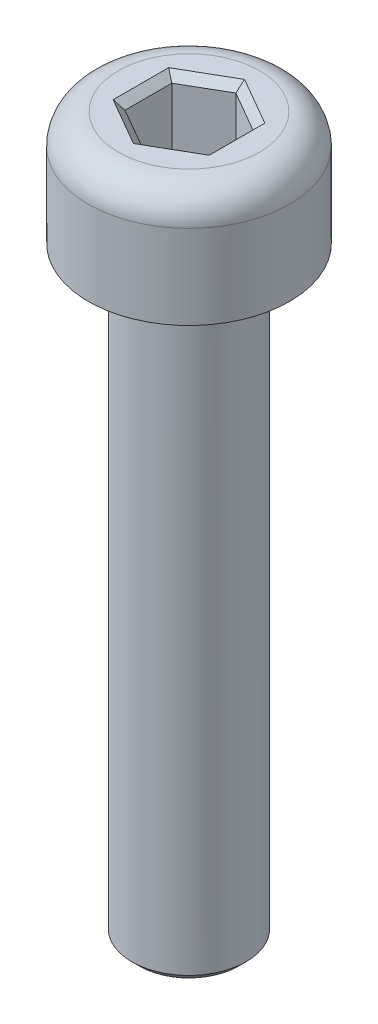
SolidWorks part; units mm, degrees
ref_plane "Alzado" through (0, 0, 0) normal (0, 0, 1) x (1, 0, 0)
ref_plane "Planta" through (0, 0, 0) normal (0, 1, 0) x (1, 0, 0)
ref_plane "Vista lateral" through (0, 0, 0) normal (1, 0, 0) x (0, 0, -1)
sketch "Croquis1" plane through (0, 0, 0) normal (0, 1, 0) x (1, 0, 0)
  circle A0 centre (0, 0) radius 3.35
  dimension "D1" = 6.7
extrude "Saliente-Extruir1" add sketch "Croquis1" along normal blind 3.8
fillet "Redondeo1" radius 1 1 edges at (0, 3.8, 3.35)
sketch "Croquis2" plane through (0, 0, 0) normal (0, -1, 0) x (1, 0, 0)
  circle A0 centre (0, 0) radius 1.9
  dimension "D1" = 3.8
extrude "Saliente-Extruir2" add sketch "Croquis2" along normal blind 20
sketch "Croquis3" plane through (0, 3.8, 0) normal (0, 1, 0) x (1, 0, 0)
  line L0 (0, 2.35) -> (0, 1.5588) construction
  line L1 (0, 1.5588) -> (-1.35, 0.7794)
  line L2 (-1.35, 0.7794) -> (-1.35, -0.7794)
  line L3 (-1.35, -0.7794) -> (0, -1.5588)
  line L4 (0, -1.5588) -> (1.35, -0.7794)
  line L5 (1.35, -0.7794) -> (1.35, 0.7794)
  line L6 (1.35, 0.7794) -> (0, 1.5588)
  line L7 (0, 1.5588) -> (0, -1.5588) construction
  line L8 (0, -1.5588) -> (0, -2.35) construction
  circle A0 centre (0, 0) radius 1.35 construction
  circle A1 centre (0, 0) radius 2.35 construction
  dimension "D1" = 2.7
extrude "Cortar-Extruir1" cut sketch "Croquis3" against normal blind 3
chamfer "Chaflán1" distance 0.25 angle 45 6 edges at (-1.35, 3.8, 0) (-0.675, 3.8, 1.1691) (0.675, 3.8, 1.1691) (1.35, 3.8, 0) (0.675, 3.8, -1.1691) (-0.675, 3.8, -1.1691)
chamfer "Chaflán2" distance 0.25 angle 45 1 edges at (0, -20, -1.9)
